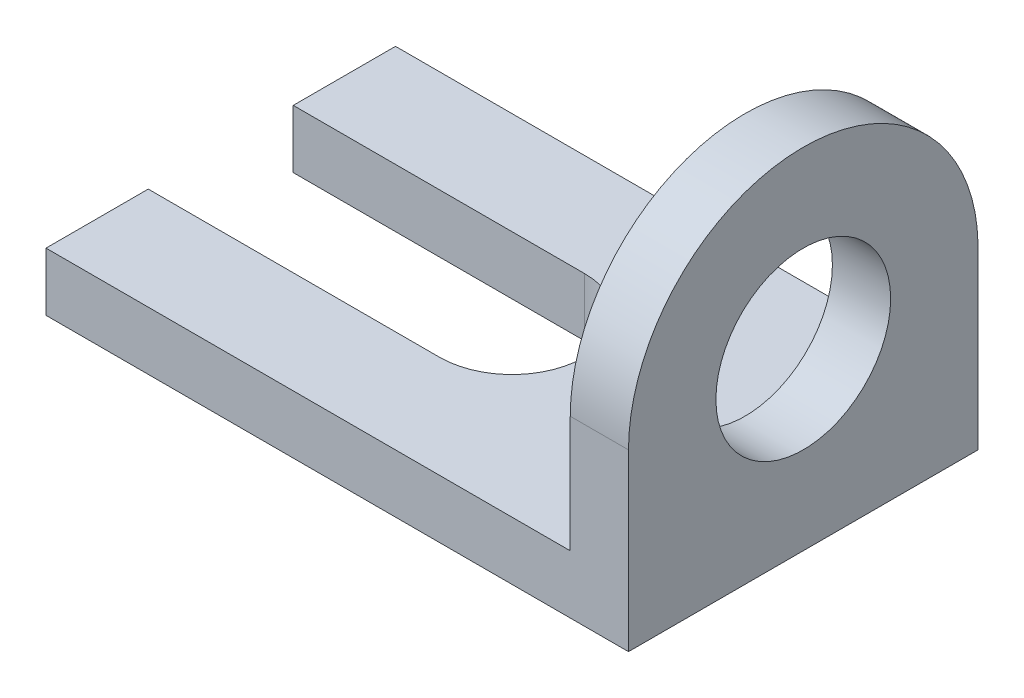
SolidWorks part; units mm, degrees
ref_plane "前视基准面" through (0, 0, 0) normal (0, 0, 1) x (1, 0, 0)
ref_plane "上视基准面" through (0, 0, 0) normal (0, 1, 0) x (1, 0, 0)
ref_plane "右视基准面" through (0, 0, 0) normal (1, 0, 0) x (0, 0, -1)
sketch "草图1" plane through (0, 0, 0) normal (0, 1, 0) x (1, 0, 0)
  line L0 (0, 0) -> (70.5983, 0) construction
  line L1 (70.5983, 0) -> (0, 0) construction
  line L2 (0, 0) -> (0, 68.3921) construction
  line L3 (-50, 12.4462) -> (0, 12.4462)
  line L4 (-50, 30) -> (50, 30)
  line L5 (-50, 30) -> (-50, 12.4462)
  line L6 (-50, -30) -> (50, -30)
  line L7 (50, 30) -> (50, -30)
  line L8 (0, -12.4462) -> (-50, -12.4462)
  line L9 (-50, -12.4462) -> (-50, -30)
  arc A0 (0, 12.4462) -> (0, -12.4462) centre (0, 0) cw
  point P0 (0, 0)
extrude "拉伸1" add sketch "草图1" along normal blind 10
sketch "草图2" plane through (50, 0, 0) normal (1, 0, 0) x (0, 0, -1)
  line L0 (-30, 10) -> (-30, 30)
  line L1 (30, 30.7617) -> (30, 10)
  line L2 (30, 10) -> (-30, 10)
  arc A0 (-30, 30) -> (30, 30.7617) centre (0.0048, 30) cw
  circle A1 centre (0.0048, 30) radius 15
extrude "拉伸2" add sketch "草图2" against normal blind 10
